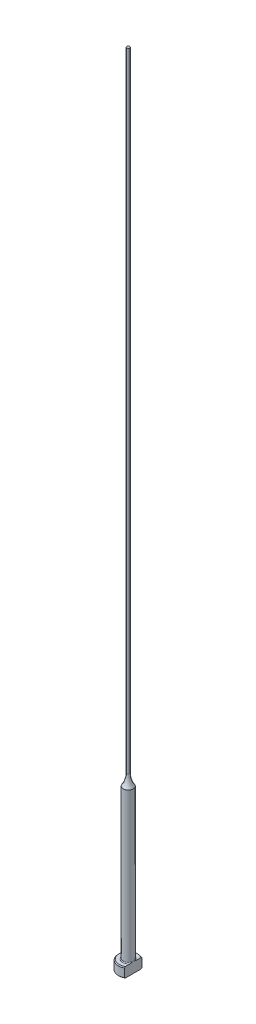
SolidWorks part; units mm, degrees
ref_plane "Front Plane" through (0, 0, 0) normal (0, 0, 1) x (1, 0, 0)
ref_plane "Top Plane" through (0, 0, 0) normal (0, 1, 0) x (1, 0, 0)
ref_plane "Right Plane" through (0, 0, 0) normal (1, 0, 0) x (0, 0, -1)
sketch "Sketch1" plane through (0, 0, 0) normal (0, 0, 1) x (1, 0, 0)
  line L0 (0, 259.9588) -> (0, -15.1925) construction
  line L1 (0, 0) -> (-3.175, 0)
  line L2 (-3.175, 0) -> (-3.175, 3.175)
  line L3 (-3.175, 3.175) -> (-1.5875, 3.175)
  line L4 (-0.4597, 54.4126) -> (-0.4597, 254)
  line L5 (-0.4597, 254) -> (0, 254)
  line L6 (0, 254) -> (0, 0)
  line L7 (-1.5875, 3.175) -> (-1.5875, 50.8)
  arc A0 (-1.5875, 50.8) -> (-0.4597, 54.4126) centre (-6.8097, 54.4126) ccw
  point P13 (-1.5875, 0)
  dimension "D1" = 6.35
  dimension "L" = 254
  dimension "D2" = 3.175
  dimension "H" = 6.35
  dimension "T" = 3.175
  dimension "D" = 0.9195
  dimension "S" = 50.8
revolve "Revolve1" add sketch "Sketch1" angle 360 about L0
chamfer "Chamfer1" distance 0.254 angle 45 2 edges at (0, 3.175, 3.175) (0, 0, 3.175)
fillet "Fillet1" radius 0.254 1 edges at (0, 3.175, 1.5875)
sketch "Sketch2" plane through (0, 0, 0) normal (0, 1, 0) x (1, 0, 0)
  line L0 (1.5875, -2.7496) -> (1.5875, 2.7496)
  circle A0 centre (0, 0) radius 3.175 construction
  arc A2 (1.5875, -2.7496) -> (1.5875, 2.7496) centre (0, 0) ccw
  circle A3 centre (0, 0) radius 3.175 construction
  circle A4 centre (0, 0) radius 1.5875 construction
extrude "Key Head" cut sketch "Sketch2" along normal up to next
